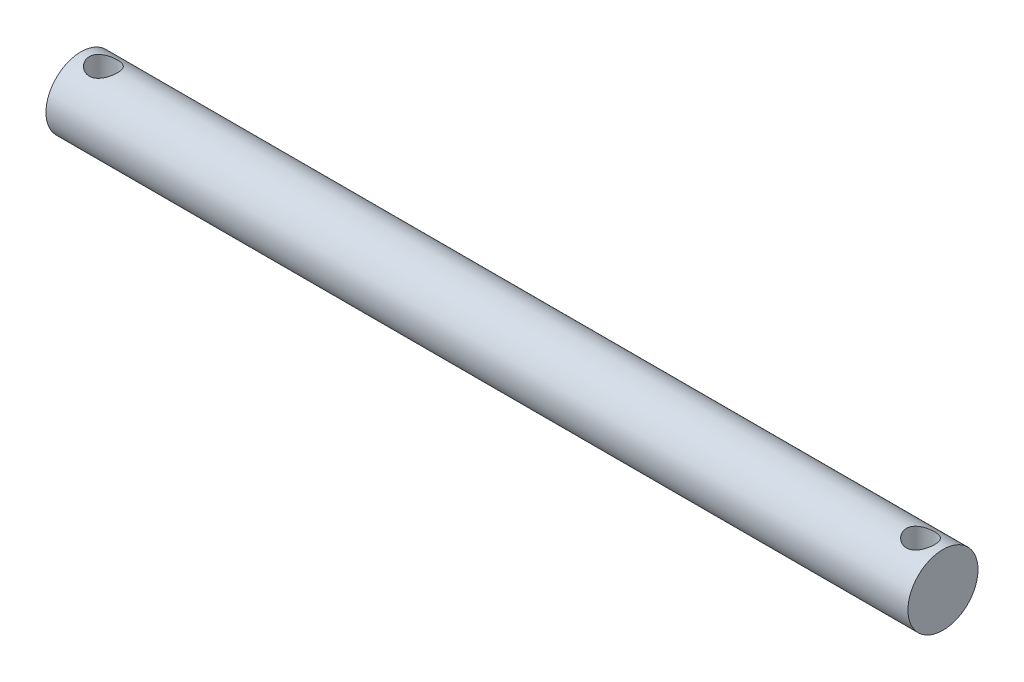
SolidWorks part; units mm, degrees
ref_plane "Front Plane" through (0, 0, 0) normal (0, 0, 1) x (1, 0, 0)
ref_plane "Top Plane" through (0, 0, 0) normal (0, 1, 0) x (1, 0, 0)
ref_plane "Right Plane" through (0, 0, 0) normal (1, 0, 0) x (0, 0, -1)
sketch "Sketch1" plane through (0, 0, 0) normal (1, 0, 0) x (0, 0, -1)
  circle A0 centre (0, 0) radius 6.35
  dimension "D1" = 12.7
extrude "Boss-Extrude1" add sketch "Sketch1" along normal mid plane 156.21
sketch "Sketch2" plane through (0, 0, 0) normal (0, 1, 0) x (1, 0, 0)
  line L0 (-74.041, 0) -> (74.041, 0) construction
  circle A0 centre (74.041, 0) radius 2.5527
  circle A1 centre (-74.041, 0) radius 2.5527
  dimension "D1" = 5.1054
  dimension "D2" = 148.082
extrude "Cut-Extrude1" cut sketch "Sketch2" against normal through all both and the other way through all
